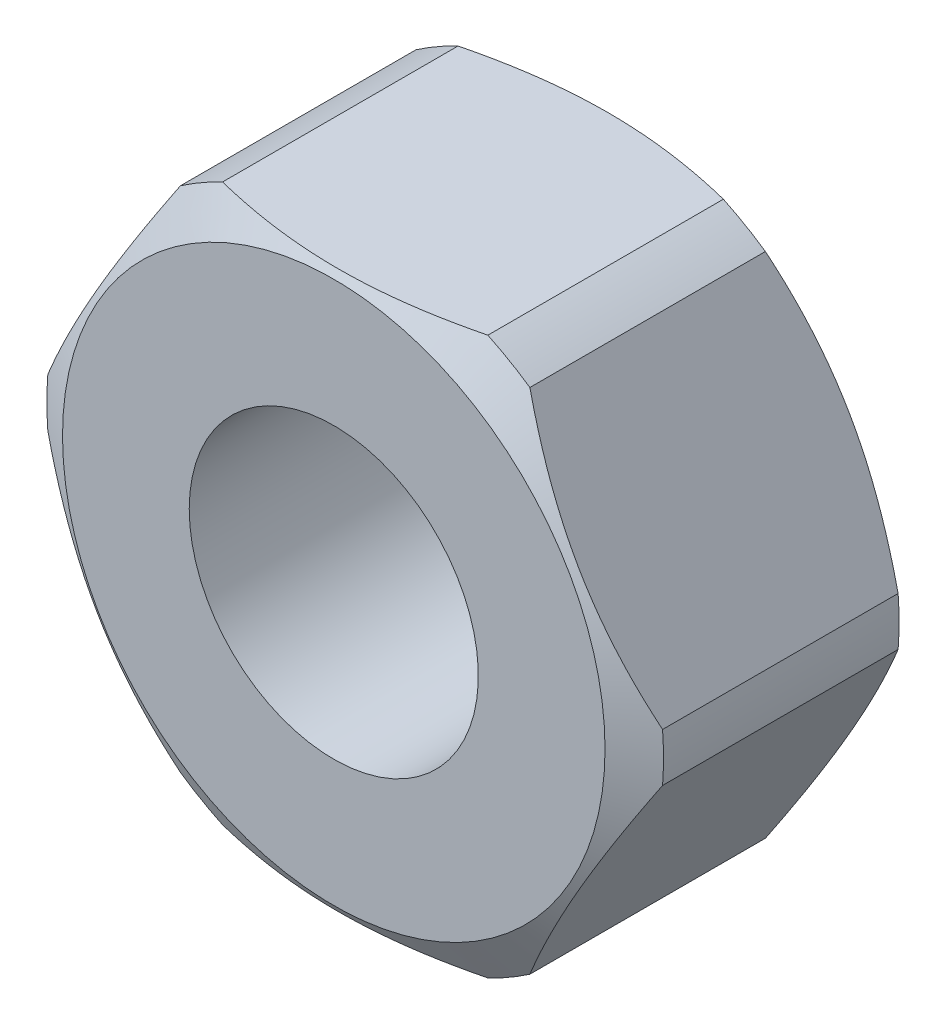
SolidWorks part; units mm, degrees
ref_plane "Plan1" through (0, 0, 0) normal (0, 0, 1) x (1, 0, 0)
ref_plane "Plan2" through (0, 0, 0) normal (0, 1, 0) x (1, 0, 0)
ref_plane "Plan3" through (0, 0, 0) normal (1, 0, 0) x (0, 0, -1)
sketch "Esquisse4" plane through (0, 0, 0) normal (0, 0, 1) x (1, 0, 0)
  circle A0 centre (0, 0) radius 7.2006
  circle A1 centre (0, 0) radius 3.3757
  dimension "D1" = 6.7513
  dimension "D2" = 14.4012
extrude "Base-Extrusion" add sketch "Esquisse4" along normal blind 6.5
chamfer "Chanfrein1" distance 0.5 angle 60
sketch "Esquisse6" plane through (0, 0, 6.5) normal (0, 0, 1) x (1, 0, 0)
  line L0 (-3.3226, 6.5) -> (3.3226, 6.5)
  line L1 (3.9676, 6.1277) -> (7.2902, 0.3727)
  line L2 (7.2902, -0.372) -> (3.9676, -6.127)
  line L3 (3.3226, -6.4994) -> (-3.3226, -6.4994)
  line L4 (-3.9676, -6.127) -> (-7.2902, -0.372)
  line L5 (-7.2902, 0.3727) -> (-3.9676, 6.1277)
  circle A0 centre (0, 0) radius 3.3757 construction
  arc A1 (3.3226, 6.5) -> (-3.3226, 6.5) centre (0, 0) ccw
  arc A3 (7.2902, 0.3727) -> (3.9676, 6.1277) centre (-0.0003, 0.0002) ccw
  arc A4 (3.9676, -6.127) -> (7.2902, -0.372) centre (-0.0003, 0.0005) ccw
  arc A5 (-3.3226, -6.4994) -> (3.3226, -6.4994) centre (0, 0.0006) ccw
  arc A6 (-7.2902, -0.372) -> (-3.9676, -6.127) centre (0.0003, 0.0005) ccw
  arc A7 (-3.9676, 6.1277) -> (-7.2902, 0.3727) centre (0.0003, 0.0002) ccw
  dimension "D1" = 6.5
  dimension "D2" = 7.3
extrude "Enlèv. mat.-Extru.3" cut sketch "Esquisse6" against normal blind 6.5
